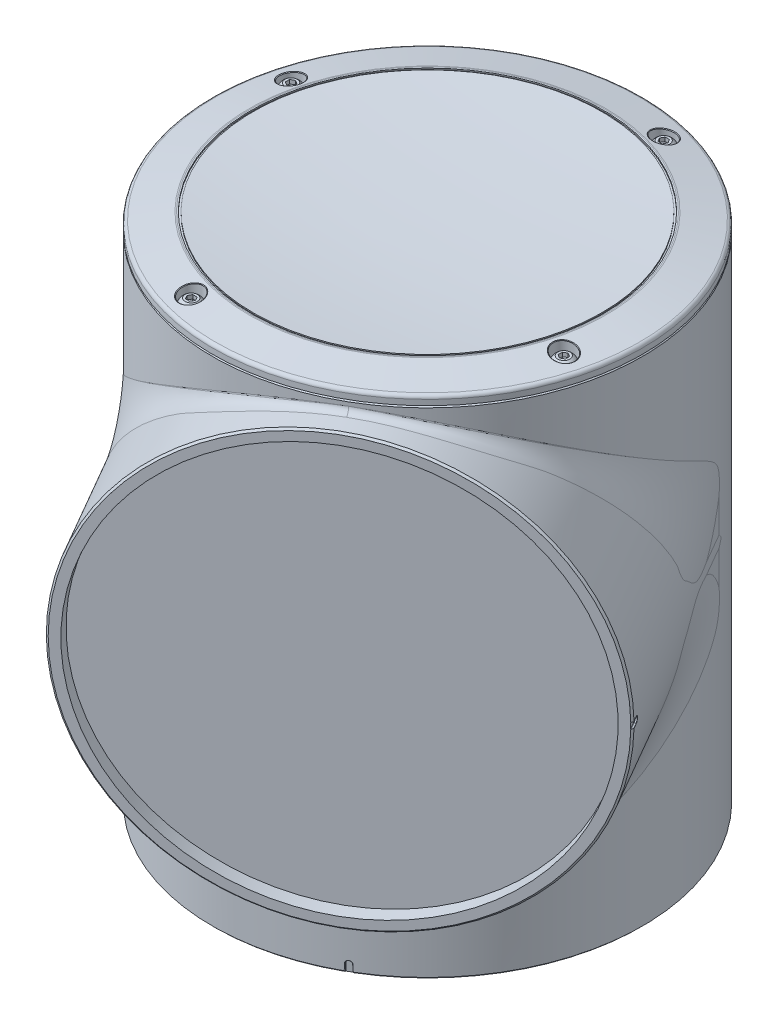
SolidWorks part; units mm, degrees
other "<4.0.07.2008582>-<输入1>"
ref_plane "前视基准面" through (0, 0, 0) normal (0, 0, 1) x (1, 0, 0)
ref_plane "上视基准面" through (0, 0, 0) normal (0, 1, 0) x (1, 0, 0)
ref_plane "右视基准面" through (0, 0, 0) normal (1, 0, 0) x (0, 0, -1)
imported_body "FR20-V6.0-5-1-1-solid1"
imported_body "FR20-V6.0-25关节后盖-1-solid1"
ref_plane "前视基准面-4.0.07.2008582" through (1453.3273, 278.55, -988.3091) normal (0, 0, 1) x (0, -1, 0)
ref_plane "上视基准面-4.0.07.2008582" through (1453.3273, 278.55, -988.3091) normal (1, 0, 0) x (0, -1, 0)
ref_plane "右视基准面-4.0.07.2008582" through (1453.3273, 278.55, -988.3091) normal (0, -1, 0) x (0, 0, -1)
inserted part "4.0.07.2008582"
move or copy body "实体-移动/复制2"
pattern_circular "阵列(圆周)1" count 4 over 360 about axis through (1403.0991, 0, -1001.7677) along (0, 1, 0)
